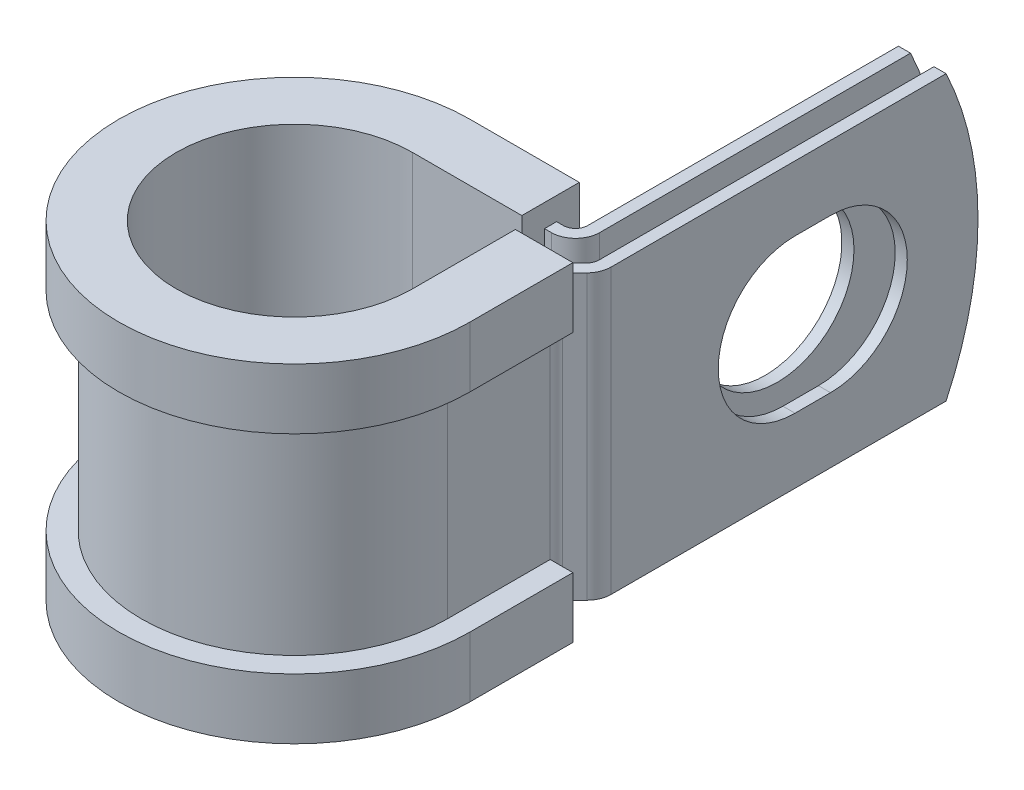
SolidWorks part; units mm, degrees
ref_plane "Front Plane" through (0, 0, 0) normal (0, 0, 1) x (1, 0, 0)
ref_plane "Top Plane" through (0, 0, 0) normal (0, 1, 0) x (1, 0, 0)
ref_plane "Right Plane" through (0, 0, 0) normal (1, 0, 0) x (0, 0, -1)
sketch "Sketch1" plane through (0, 0, 0) normal (0, 1, 0) x (1, 0, 0)
  line L0 (0, 9.4615) -> (7.8015, 9.4615)
  line L1 (9.4615, 0) -> (9.4615, 6.9111)
  line L2 (9.4271, 34.1122) -> (9.4271, 11.0871)
  line L3 (9.9376, 8.0606) -> (10.7638, 8.8868)
  line L5 (11.0019, 9.4615) -> (11.0019, 34.1122)
  arc A0 (0, 9.4615) -> (9.4615, 0) centre (0, 0) ccw
  arc A1 (9.9376, 8.0606) -> (9.4615, 6.9111) centre (11.0871, 6.9111) ccw
  arc A2 (10.7638, 8.8868) -> (11.0019, 9.4615) centre (10.1891, 9.4615) ccw
  arc A3 (7.8015, 9.4615) -> (9.4271, 11.0871) centre (7.8015, 11.0871) ccw
extrude "Extrude-Thin1" add sketch "Sketch1" along normal mid plane 19.05 thin
sketch "Sketch2" plane through (8.6143, 0, 0) normal (-1, 0, 0) x (0, 0, 1)
  line L0 (-34.1122, 9.525) -> (-34.1122, -9.525) construction
  line L1 (0, 9.525) -> (0, -9.525) construction
  circle A0 centre (-23.0124, 0) radius 5.1562
  point P2 (-34.1122, 0)
extrude "Cut-Extrude1" cut sketch "Sketch2" against normal up to surface (0.8128 mm away)
sketch "Sketch3" plane through (11.8147, 0, 0) normal (1, 0, 0) x (0, 0, -1)
  line L0 (21.8186, 0) -> (24.2062, 0) construction
  line L1 (21.8186, 5.1562) -> (24.2062, 5.1562)
  line L2 (21.8186, -5.1562) -> (24.2062, -5.1562)
  line L3 (34.1122, 9.525) -> (34.1122, -9.525) construction
  arc A0 (21.8186, 5.1562) -> (21.8186, -5.1562) centre (21.8186, 0) ccw
  arc A1 (24.2062, -5.1562) -> (24.2062, 5.1562) centre (24.2062, 0) ccw
  point P3 (23.0124, 0)
  point P8 (34.1122, 0)
  point P11 (16.6624, 0)
  point P12 (29.3624, 0)
extrude "Cut-Extrude2" cut sketch "Sketch3" against normal up to surface (0.8128 mm away)
sketch "Sketch4" plane through (8.6143, 0, 0) normal (-1, 0, 0) x (0, 0, 1)
  line L0 (-34.1122, 9.525) -> (-34.1122, -9.525)
  line L1 (-34.1122, 9.525) -> (-31.9677, 9.525)
  line L2 (-34.1122, 9.525) -> (-11.0871, 9.525) construction
  line L3 (-34.1122, -9.525) -> (-31.9677, -9.525)
  line L4 (-34.1122, -9.525) -> (-11.0871, -9.525) construction
  arc A0 (-31.9677, 9.525) -> (-31.9677, -9.525) centre (-11.8872, 0) ccw
extrude "Cut-Extrude3" cut sketch "Sketch4" against normal through all contours A0 M4 M5 | A0 L0 M2
ref_plane "Plane1" through (0, 0, -6.9111) normal (0, 0, -1) x (-1, 0, 0)
ref_plane "Plane2" through (7.3443, 0, 0) normal (-1, 0, 0) x (0, 0, 1)
sketch "Sketch5" plane through (0, 0, -6.9111) normal (0, 0, -1) x (-1, 0, 0)
  line L0 (-10.2743, 9.525) -> (-9.4615, 9.525)
  line L1 (-10.2743, 9.525) -> (-10.2743, -9.525) construction
  line L3 (-9.4615, 9.525) -> (-9.4615, -9.525)
  line L4 (-9.4615, -9.525) -> (-10.2743, -9.525)
  line L5 (-10.2743, -9.525) -> (-10.2743, -6.985)
  line L6 (-10.2743, 9.525) -> (-10.2743, 6.985)
  line L7 (-11.7983, 11.049) -> (-11.7983, 6.985)
  line L8 (-11.7983, 11.049) -> (-7.9375, 11.049)
  line L9 (-7.9375, 11.049) -> (-7.9375, -11.049)
  line L10 (-7.9375, -11.049) -> (-11.7983, -11.049)
  line L11 (-11.7983, -11.049) -> (-11.7983, -6.985)
  line L12 (-11.7983, 6.985) -> (-10.2743, 6.985)
  line L13 (-10.2743, -6.985) -> (-11.7983, -6.985)
sketch "Sketch6" plane through (0, 9.525, 0) normal (0, 1, 0) x (1, 0, 0)
  line L0 (7.9375, 0) -> (7.9375, 6.9111)
  line L1 (7.9375, 6.9111) -> (11.7983, 6.9111) construction
  line L2 (7.3443, 6.9878) -> (7.3443, -6.9878) construction
  line L5 (0, 7.9375) -> (7.3443, 7.9375)
  arc A0 (0, 7.9375) -> (7.9375, 0) centre (0, 0) ccw
sweep "Sweep1" add profiles "Sketch5" path "Sketch6"
equation "\"D4@Sketch5\" = \"D1@Extrude-Thin1\""
equation "\"D5@Sketch5\" = \"D5@Extrude-Thin1\""
equation "\"D1@Sketch3\" = \"D2@Sketch2\""
equation "\"D7@Sketch1\" = \"D3@Sketch2\" + \"D1@Sketch3\""
equation "\"D1@Sketch1\" = \"D1@Sketch6\" + 2 * \"D3@Sketch5\""
equation "\"D1@Sketch4\" = ( \"D1@Extrude-Thin1\" + .125 ) * 2"
equation "\"D9@Sketch1\"= \"D5@Extrude-Thin1\""
equation "\"D8@Sketch1\"= 2 * \"D5@Extrude-Thin1\""
equation "\"D2@Sketch1\" = 2 * \"D5@Extrude-Thin1\""
equation "\"D2@Sketch3\" = \"D1@Sketch2\""
